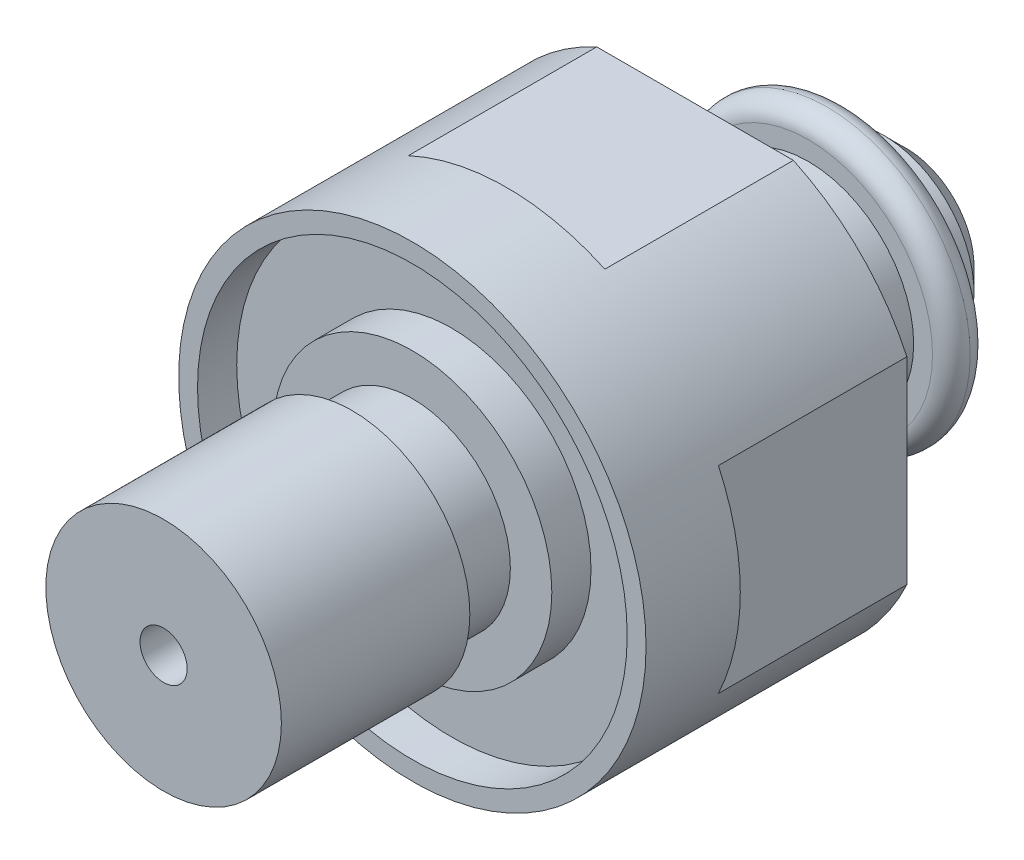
SolidWorks part; units mm, degrees
ref_plane "Plane1" through (0, 0, 0) normal (0, 0, 1) x (1, 0, 0)
ref_plane "Plane2" through (0, 0, 0) normal (0, 1, 0) x (1, 0, 0)
ref_plane "Plane3" through (0, 0, 0) normal (1, 0, 0) x (0, 0, -1)
sketch "Sketch1" plane through (0, 0, 0) normal (0, 0, 1) x (1, 0, 0)
  circle A0 centre (0, 0) radius 7.874
  dimension "D1" = 15.748
extrude "Base-Extrude" add sketch "Sketch1" against normal blind 9.525
sketch "Sketch2" plane through (0, 0, 0) normal (0, 0, 1) x (1, 0, 0)
  circle A0 centre (0, 0) radius 3.302
  dimension "D1" = 6.604
extrude "thread_undercut" add sketch "Sketch2" along normal blind 2.032
sketch "Sketch3" plane through (0, 0, 2.032) normal (0, 0, 1) x (1, 0, 0)
  circle A0 centre (0, 0) radius 3.9688
  dimension "D1" = 7.9375
extrude "threads" add sketch "Sketch3" along normal blind 6.35
sketch "Sketch4" plane through (0, 0, 0) normal (0, 0, 1) x (1, 0, 0)
  circle A0 centre (0, 0) radius 4.699
  circle A1 centre (0, 0) radius 7.239
  dimension "D1" = 9.398
  dimension "D2" = 14.478
extrude "oring_groove" cut sketch "Sketch4" against normal blind 1.3208
sketch "Sketch5" plane through (0, 0, -9.525) normal (0, 0, -1) x (-1, 0, 0)
  circle A0 centre (0, 0) radius 3.556
  dimension "D1" = 7.112
extrude "male_1" add sketch "Sketch5" along normal blind 3.81
sketch "Sketch6" plane through (0, 0, -13.335) normal (0, 0, -1) x (-1, 0, 0)
  circle A0 centre (0, 0) radius 4.826
  dimension "D1" = 9.652
extrude "male_2" add sketch "Sketch6" along normal blind 1.27
sketch "Sketch7" plane through (0, 0, -14.605) normal (0, 0, -1) x (-1, 0, 0)
  circle A0 centre (0, 0) radius 3.048
  dimension "D1" = 6.096
extrude "male_3" add sketch "Sketch7" along normal blind 2.032
sketch "Sketch8" plane through (0, 0, -16.637) normal (0, 0, -1) x (-1, 0, 0)
  circle A0 centre (0, 0) radius 0.7937
  dimension "D1" = 1.5875
extrude "thru_hole" cut sketch "Sketch8" against normal through all
fillet "Fillet1" radius 0.635 2 edges at (-4.826, 0, -13.335) (-4.826, 0, -14.605)
chamfer "Chamfer1" distance 0.762 angle 45 1 edges at (-3.048, 0, -16.637)
sketch "Sketch9" plane through (0, 0, -9.525) normal (0, 0, -1) x (-1, 0, 0)
  line L0 (0, 0) -> (0, 7.1437) construction
  line L1 (-10.16, 7.1437) -> (10.16, 7.1437)
  line L2 (10.16, 7.1437) -> (10.16, 10.16)
  line L3 (10.16, 10.16) -> (-10.16, 10.16)
  line L4 (-10.16, 7.1437) -> (-10.16, 10.16)
  line L5 (0, 0) -> (5.08, 0) construction
  line L6 (-10.16, -7.1437) -> (-10.16, -10.16)
  line L7 (10.16, -10.16) -> (-10.16, -10.16)
  line L8 (10.16, -7.1437) -> (10.16, -10.16)
  line L9 (-10.16, -7.1437) -> (10.16, -7.1437)
  line L10 (-7.1374, -5.0179) -> (-7.1374, 0)
  line L11 (7.1374, 0) -> (7.1374, 4.8419)
  line L12 (7.1374, 4.8419) -> (10.16, 4.8419)
  line L13 (10.16, 4.8419) -> (10.16, -5.0179)
  line L14 (10.16, -5.0179) -> (7.1374, -5.0179)
  line L15 (7.1374, -5.0179) -> (7.1374, 0)
  line L16 (-10.16, -5.0179) -> (-7.1374, -5.0179)
  line L17 (-10.16, 4.8419) -> (-10.16, -5.0179)
  line L18 (-7.1374, 4.8419) -> (-10.16, 4.8419)
  line L19 (-7.1374, 0) -> (-7.1374, 4.8419)
  point P8 (0, 10.16)
  point P13 (0, -10.16)
  dimension "D1" = 7.1437
extrude "Cut-Extrude1" cut sketch "Sketch9" against normal blind 6.35
